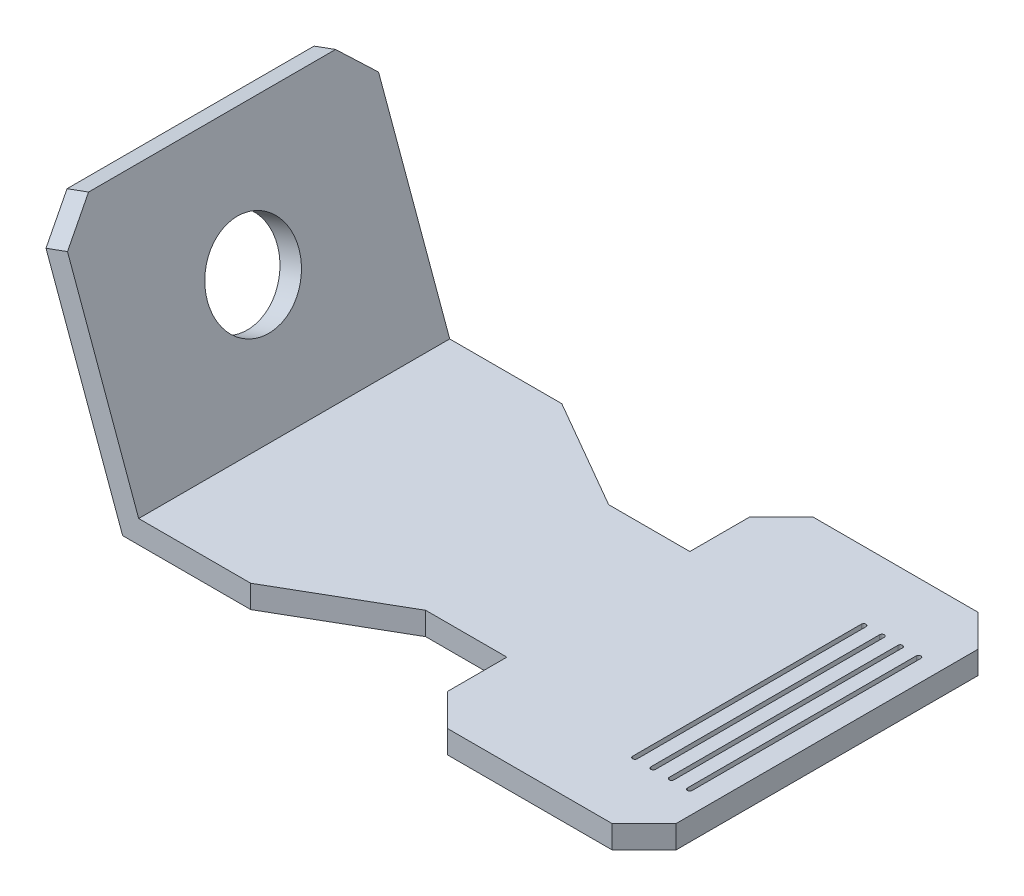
SolidWorks part; units mm, degrees
ref_plane "Front" through (0, 0, 0) normal (0, 0, 1) x (1, 0, 0)
ref_plane "Top" through (0, 0, 0) normal (0, 1, 0) x (1, 0, 0)
ref_plane "Right" through (0, 0, 0) normal (1, 0, 0) x (0, 0, -1)
sketch "Sketch2" plane through (0, 0, 0) normal (0, 1, 0) x (1, 0, 0)
  line L0 (0, 0) -> (-120, 0) construction
  line L1 (0, -40) -> (0, 40)
  line L2 (0, 40) -> (-50, 40)
  line L3 (0, -40) -> (-50, -40)
  line L4 (-50, 40) -> (-50, 20)
  line L5 (-50, -40) -> (-50, -20)
  line L6 (-50, 20) -> (-67.7513, 20)
  line L7 (-50, -20) -> (-67.7513, -20)
  line L8 (-67.7513, 20) -> (-92, 34)
  line L9 (-67.7513, -20) -> (-92, -34)
  line L10 (-92, 34) -> (-120, 34)
  line L11 (-92, -34) -> (-120, -34)
  line L12 (-120, 34) -> (-120, -34)
  dimension "D1" = 80
  dimension "D2" = 40
  dimension "D3" = 50
  dimension "D4" = 150
  dimension "D5" = 120
  dimension "D6" = 68
  dimension "D7" = 28
extrude "Boss-Extrude1" add sketch "Sketch2" along normal blind 5
sketch "Sketch3" plane through (0, 0, 0) normal (0, 0, 1) x (1, 0, 0)
  line L0 (-120, 0) -> (-139.1531, 52.6228)
  line L1 (-139.1531, 52.6228) -> (-134.4547, 54.3329)
  line L2 (-115.3015, 1.7101) -> (-134.4547, 54.3329)
  line L3 (-115.3015, 1.7101) -> (-120, 0)
  line L4 (-120, 5) -> (-92, 5) construction
  dimension "D2" = 110
  dimension "D3" = 56
extrude "Boss-Extrude2" add sketch "Sketch3" along normal up to surface and the other way up to surface
sketch "Sketch4" plane through (0, 5, 0) normal (0, 1, 0) x (1, 0, 0)
  line L0 (-5, -25) -> (-5, 25) construction
  line L1 (-5.5, -25) -> (-5.5, 25)
  line L2 (-4.5, -25) -> (-4.5, 25)
  line L5 (0, -40) -> (0, 40) construction
  line L6 (0, 40) -> (-50, 40) construction
  arc A0 (-5.5, -25) -> (-4.5, -25) centre (-5, -25) ccw
  arc A1 (-4.5, 25) -> (-5.5, 25) centre (-5, 25) ccw
  point P2 (-5, 0)
  dimension "D1" = 1
  dimension "D2" = 5
  dimension "D3" = 15
extrude "Cut-Extrude1" cut sketch "Sketch4" against normal through all
pattern_linear "LPattern1" count 4 spacing 4 along (-1, 0, 0) of "Cut-Extrude1"
sketch "Sketch5" plane through (-101.2642, -36.8572, 0) normal (0.9397, 0.342, 0) x (0, 0, -1)
  line L0 (0, 44.5435) -> (0, 97.0424) construction
  line L1 (34, 44.5435) -> (-34, 44.5435) construction
  line L2 (-34, 97.0424) -> (34, 97.0424) construction
  circle A0 centre (0, 70.7929) radius 10
  dimension "D1" = 20
extrude "Cut-Extrude2" cut sketch "Sketch5" against normal up to next
chamfer "Chamfer1" distance 7 angle 45 6 edges at (-136.8039, 53.4778, 34) (-136.8039, 53.4778, -34) (0, 2.5, -40) (0, 2.5, 40) (-50, 2.5, -40) (-50, 2.5, 40)
